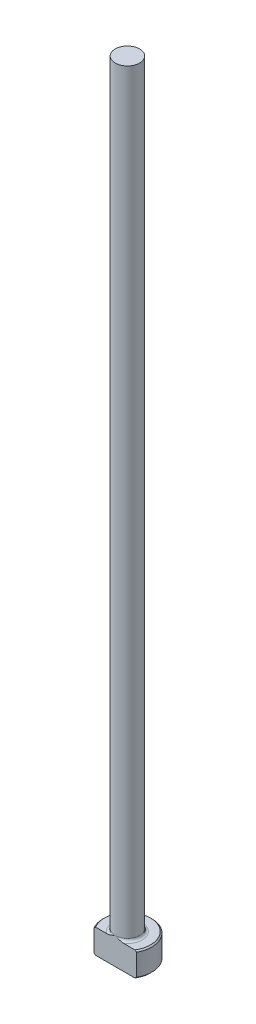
SolidWorks part; units mm, degrees
ref_plane "Front Plane" through (0, 0, 0) normal (0, 0, 1) x (1, 0, 0)
ref_plane "Top Plane" through (0, 0, 0) normal (0, 1, 0) x (1, 0, 0)
ref_plane "Right Plane" through (0, 0, 0) normal (1, 0, 0) x (0, 0, -1)
sketch "Sketch1" plane through (0, 0, 0) normal (0, 0, 1) x (1, 0, 0)
  line L0 (0, 259.9588) -> (0, -15.1925) construction
  line L1 (0, 0) -> (-4.7625, 0)
  line L2 (-4.7625, 0) -> (-4.7625, 4.7498)
  line L3 (-4.7625, 4.7498) -> (-2.3812, 4.7498)
  line L4 (-2.3812, 4.7498) -> (-2.3812, 152.4)
  line L5 (-2.3812, 152.4) -> (0, 152.4)
  line L6 (0, 152.4) -> (0, 0)
  dimension "L" = 152.4
  dimension "H" = 9.525
  dimension "T" = 4.7498
  dimension "D" = 4.7625
revolve "Revolve1" add sketch "Sketch1" angle 360 about L0
chamfer "Chamfer1" distance 0.254 angle 45 2 edges at (0, 4.7498, 4.7625) (0, 0, 4.7625)
fillet "Fillet1" radius 0.508 1 edges at (0, 4.7498, 2.3812)
sketch "Sketch2" plane through (0, 0, 0) normal (0, 1, 0) x (1, 0, 0)
  line L0 (-4.1244, -2.3812) -> (4.1244, -2.3812)
  circle A0 centre (0, 0) radius 4.7625 construction
  arc A1 (-4.1244, -2.3812) -> (4.1244, -2.3812) centre (0, 0) ccw
  circle A3 centre (0, 0) radius 2.3812 construction
  dimension "D1" = 0
extrude "Key" cut sketch "Sketch2" along normal through all
sketch "Pocket Sketch" plane through (0, 0, 0) normal (0, 0, 1) x (1, 0, 0)
  line L0 (-5.1594, 0) -> (-5.1594, 4.7752)
  line L1 (-5.1594, 4.7752) -> (-3.3417, 4.7752)
  line L2 (-2.5797, 5.5372) -> (-2.5797, 22.225)
  line L3 (-2.5797, 22.225) -> (0, 22.225)
  line L4 (0, 22.225) -> (0, 0)
  line L5 (0, 0) -> (-5.1594, 0)
  line L6 (0, 12.6104) -> (0, -2.4989) construction
  line L7 (-4.7625, 4.4958) -> (-4.7625, 0.254) construction
  line L8 (4.5085, 4.7498) -> (-4.5085, 4.7498) construction
  line L9 (-2.3812, 152.4) -> (-2.3812, 5.2578) construction
  line L10 (-3.3417, 4.7752) -> (-2.5797, 5.5372)
  point P3 (-2.5797, 4.7752)
  dimension "D1" = 10.3187
  dimension "D2" = 0.3969
  dimension "D3" = 0.0254
  dimension "D4" = 0.1984
  dimension "D5" = 5.1594
  dimension "D6" = 22.225
